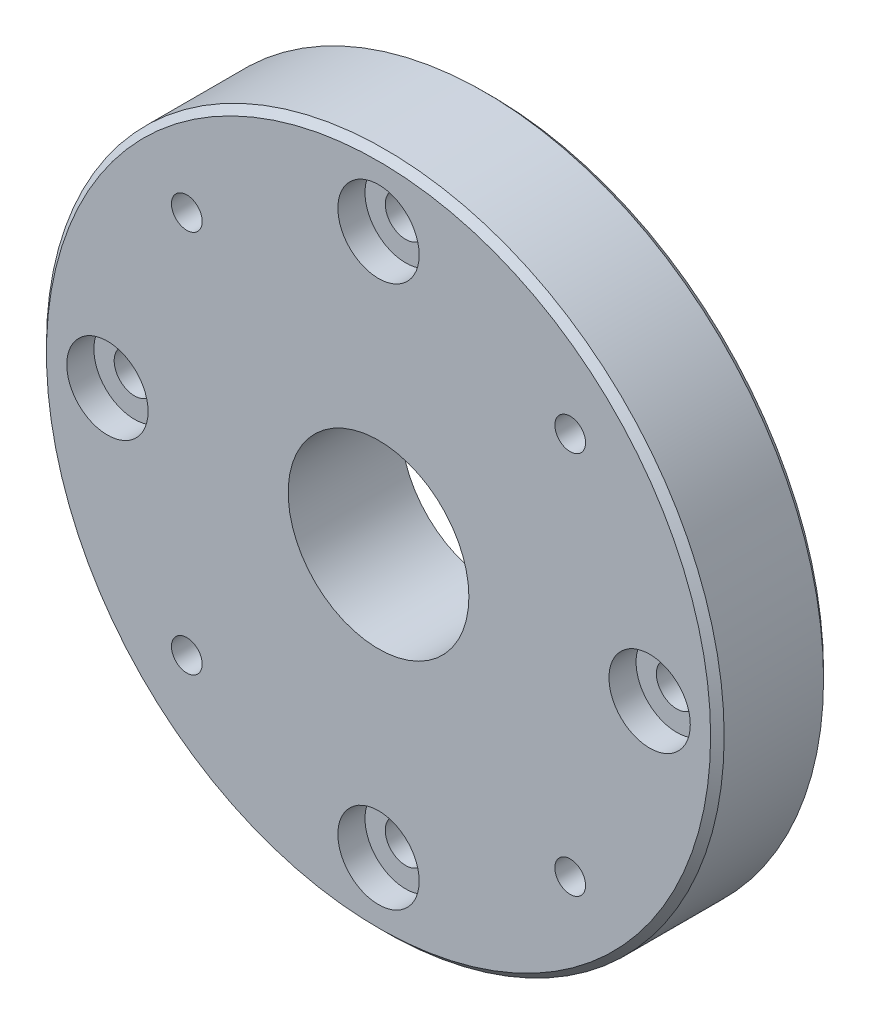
SolidWorks part; units mm, degrees
ref_plane "Ebene vorne" through (0, 0, 0) normal (0, 0, 1) x (1, 0, 0)
ref_plane "Ebene oben" through (0, 0, 0) normal (0, 1, 0) x (1, 0, 0)
ref_plane "Ebene rechts" through (0, 0, 0) normal (1, 0, 0) x (0, 0, -1)
sketch "Skizze1" plane through (0, 0, 0) normal (0, 0, 1) x (1, 0, 0)
  circle A0 centre (0, 0) radius 75
  dimension "D1" = 150
extrude "Aufsatz-Linear austragen1" add sketch "Skizze1" along normal blind 25
sketch "Skizze2" plane through (0, 0, 25) normal (0, 0, 1) x (1, 0, 0)
  line L0 (0, 0) -> (0, 60) construction
  line L1 (0, 0) -> (42.4264, 42.4264) construction
  dimension "D1" = 60
  dimension "D2" = 60
  dimension "D3" = 45
hole_wizard "Stirnsenkung für M8 Flachkopfschraube mit Schlitz1" positions "3D-Skizze1" profile "Skizze3" counterbore size "M8" standard "DIN"
sketch3d "3D-Skizze1"
  point P0 (0, 60, 25)
sketch "Skizze3" plane through (0, 60, 25) normal (1, 0, 0) x (0, -1, 0)
  line L0 (0, 0) -> (0, 25)
  line L1 (0, 25) -> (4.5, 25)
  line L3 (4.5, 25) -> (4.5, 6)
  line L4 (4.5, 6) -> (9, 6)
  line L5 (9, 6) -> (9, 0)
  line L7 (9, 0) -> (0, 0)
  line L11 (0, -6.35) -> (0, 107.95) construction
  dimension "Bohrerdurchmesser" = 9
  dimension "Bohrungstiefe" = 25
  dimension "Senkdurchmesser2" = 18
  dimension "Senktiefe2" = 6
hole_wizard "M8 Gewindebohrung1" positions "3D-Skizze2" profile "Skizze4" tap size "M8" standard "DIN"
sketch3d "3D-Skizze2"
  point P0 (42.4264, 42.4264, 25)
sketch "Skizze4" plane through (42.4264, 42.4264, 25) normal (1, 0, 0) x (0, -1, 0)
  line L0 (0, 0) -> (0, 25)
  line L1 (0, 25) -> (3.4, 25)
  line L2 (3.4, 25) -> (3.4, 0)
  line L5 (3.4, 0) -> (0, 0)
  line L11 (0, -6.35) -> (0, 107.95) construction
  dimension "Bohrerdurchmesser" = 6.8
  dimension "Bohrungstiefe" = 25
pattern_circular "Kreismuster1" count 4 over 360 about axis through (0, 0, 0) along (0, 0, 1) of "M8 Gewindebohrung1", "Stirnsenkung für M8 Flachkopfschraube mit Schlitz1"
chamfer "Fase1" distance 1.5 angle 45 2 edges at (75, 0, 0) (75, 0, 25)
sketch "Skizze5" plane through (0, 0, 25) normal (0, 0, 1) x (1, 0, 0)
  circle A0 centre (0, 0) radius 20
  dimension "D1" = 40
extrude "Schnitt-Linear austragen1" cut sketch "Skizze5" against normal through all
